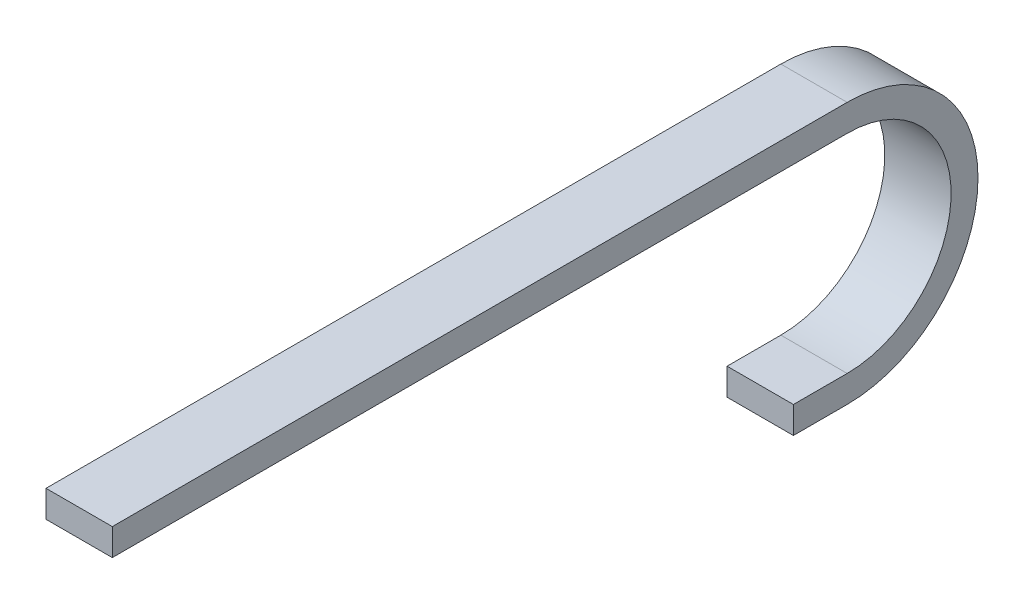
SolidWorks part; units mm, degrees
ref_plane "Plan de face" through (0, 0, 0) normal (0, 0, 1) x (1, 0, 0)
ref_plane "Plan de dessus" through (0, 0, 0) normal (0, 1, 0) x (1, 0, 0)
ref_plane "Plan de droite" through (0, 0, 0) normal (1, 0, 0) x (0, 0, -1)
sketch "Esquisse1" plane through (0, 0, 0) normal (0, 0, 1) x (1, 0, 0)
  line L1 (-18.5, 7.5) -> (18.5, 7.5)
  line L2 (-18.5, 7.5) -> (-18.5, -7.5)
  line L3 (-18.5, -7.5) -> (18.5, -7.5)
  line L4 (18.5, 7.5) -> (18.5, -7.5)
  dimension "D1" = 37
  dimension "D2" = 15
  dimension "D3" = 7.5
  dimension "D4" = 18.5
sketch "Esquisse4" plane through (0, 0, 0) normal (1, 0, 0) x (0, 0, -1)
  line L0 (0, 0) -> (410, 0)
  line L1 (410, -131) -> (380, -131)
  arc A0 (410, 0) -> (410, -131) centre (410, -65.5) cw
  dimension "D1" = 131
  dimension "D2" = 410
  dimension "D3" = 380
sweep "Balayage1" add profiles "Esquisse1" path "Esquisse4"
